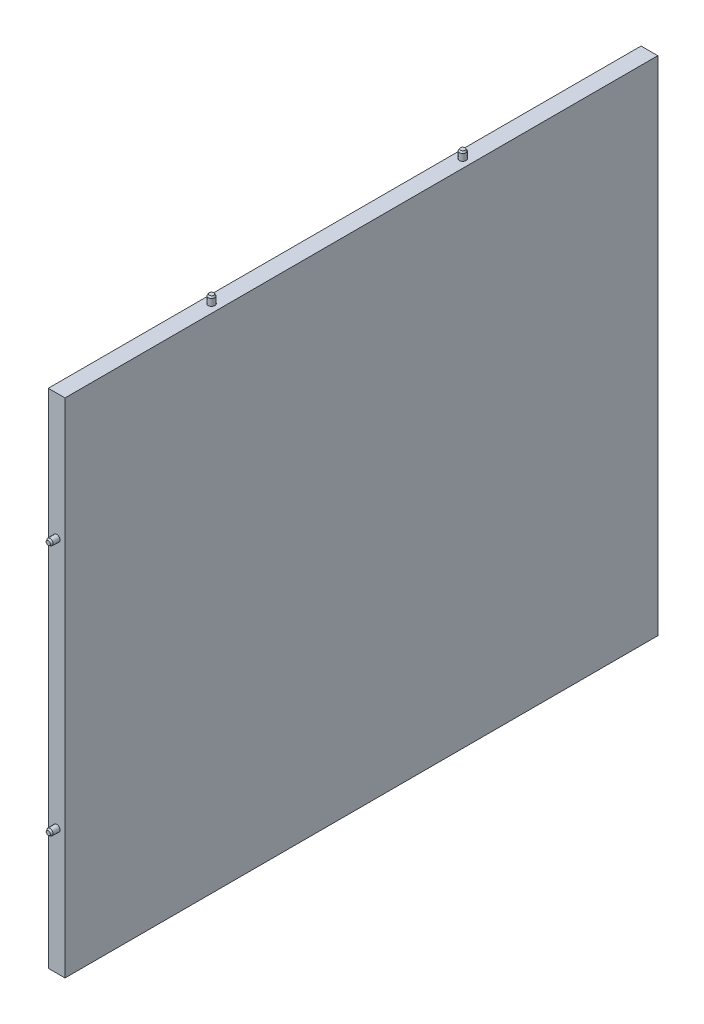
SolidWorks part; units mm, degrees
ref_plane "Front Plane" through (0, 0, 0) normal (0, 0, 1) x (1, 0, 0)
ref_plane "Top Plane" through (0, 0, 0) normal (0, 1, 0) x (1, 0, 0)
ref_plane "Right Plane" through (0, 0, 0) normal (1, 0, 0) x (0, 0, -1)
sketch "Sketch1" plane through (0, 0, 0) normal (1, 0, 0) x (0, 0, -1)
  line L1 (-162.5, -150) -> (162.5, -150)
  line L2 (-162.5, -150) -> (-162.5, 150)
  line L3 (-162.5, 150) -> (162.5, 150)
  line L4 (162.5, -150) -> (162.5, 150)
  line L5 (-162.5, -150) -> (162.5, 150) construction
  line L6 (-162.5, 150) -> (162.5, -150) construction
  point P0 (0, 0)
  dimension "D1" = 325
  dimension "D2" = 300
extrude "Boss-Extrude1" add sketch "Sketch1" along normal blind 10
sketch "Sketch2" plane through (0, 0, 162.5) normal (0, 0, 1) x (1, 0, 0)
  line L0 (5, 150) -> (5, -150) construction
  line L1 (10, 150) -> (0, 150) construction
  line L2 (10, -150) -> (0, -150) construction
  line L3 (0, 0) -> (59.3661, 0) construction
  line L4 (0, 150) -> (0, -150) construction
  circle A0 centre (5, 75) radius 2
  circle A1 centre (5, -75) radius 2
  dimension "D1" = 4
  dimension "D2" = 150
extrude "Boss-Extrude2" add sketch "Sketch2" along normal blind 5 draft 2
mirror "Mirror3" [suppressed] about plane through (0, 0, 0) normal (0, 0, 1)
sketch "Sketch3" plane through (0, 150, 0) normal (0, 1, 0) x (1, 0, 0)
  line L0 (5, 5) -> (68.8381, 5) construction
  line L2 (5, -162.5) -> (5, 162.5) construction
  line L3 (10, -162.5) -> (0, -162.5) construction
  line L4 (10, 162.5) -> (0, 162.5) construction
  line L5 (0, 0) -> (-67.6834, 0) construction
  line L6 (0, 162.5) -> (0, -162.5) construction
  circle A0 centre (5, -70) radius 2
  circle A1 centre (5, 80) radius 2
  dimension "D1" = 4
  dimension "D2" = 150
  dimension "D3" = 5
extrude "Boss-Extrude3" add sketch "Sketch3" along normal blind 5 draft 1
chamfer "Chamfer1" [suppressed] distance 1 angle 30
sketch "Sketch4" plane through (0, 0, 0) normal (-1, 0, 0) x (0, 0, 1)
  line L0 (-162.5, 0) -> (162.5, 0) construction
  line L1 (-162.5, -150) -> (-162.5, 150) construction
  line L2 (162.5, 150) -> (162.5, -150) construction
  line L3 (0, 0) -> (0, 75) construction
  line L4 (-162.5, 75) -> (162.5, 75) construction
  line L5 (-162.5, -75) -> (162.5, -75) construction
  line L6 (-162.5, -150) -> (162.5, -150) construction
  circle A0 centre (-100, -75) radius 2
  circle A1 centre (100, -75) radius 2
  circle A2 centre (100, 75) radius 2
  circle A3 centre (-100, 75) radius 2
  dimension "D1" = 4
  dimension "D2" = 200
extrude "Cut-Extrude1" cut sketch "Sketch4" against normal blind 5
chamfer "Chamfer2" distance 1 angle 30 4 edges at (3.1746, -75, 167.5) (6.8254, 75, 167.5) (5, 155, 71.9127) (5, 155, -81.9127)
sketch "Sketch5" plane through (0, 0, 0) normal (-1, 0, 0) x (0, 0, 1)
  line L0 (162.5, -150) -> (-162.5, -150) construction
  line L1 (-162.5, 150) -> (-191.5, 150)
  line L2 (-162.5, 150) -> (-162.5, -150)
  line L3 (-162.5, -150) -> (-191.5, -150)
  line L4 (-191.5, 150) -> (-191.5, -150)
  dimension "D1" = 29
extrude "Boss-Extrude4" add sketch "Sketch5" against normal blind 10
